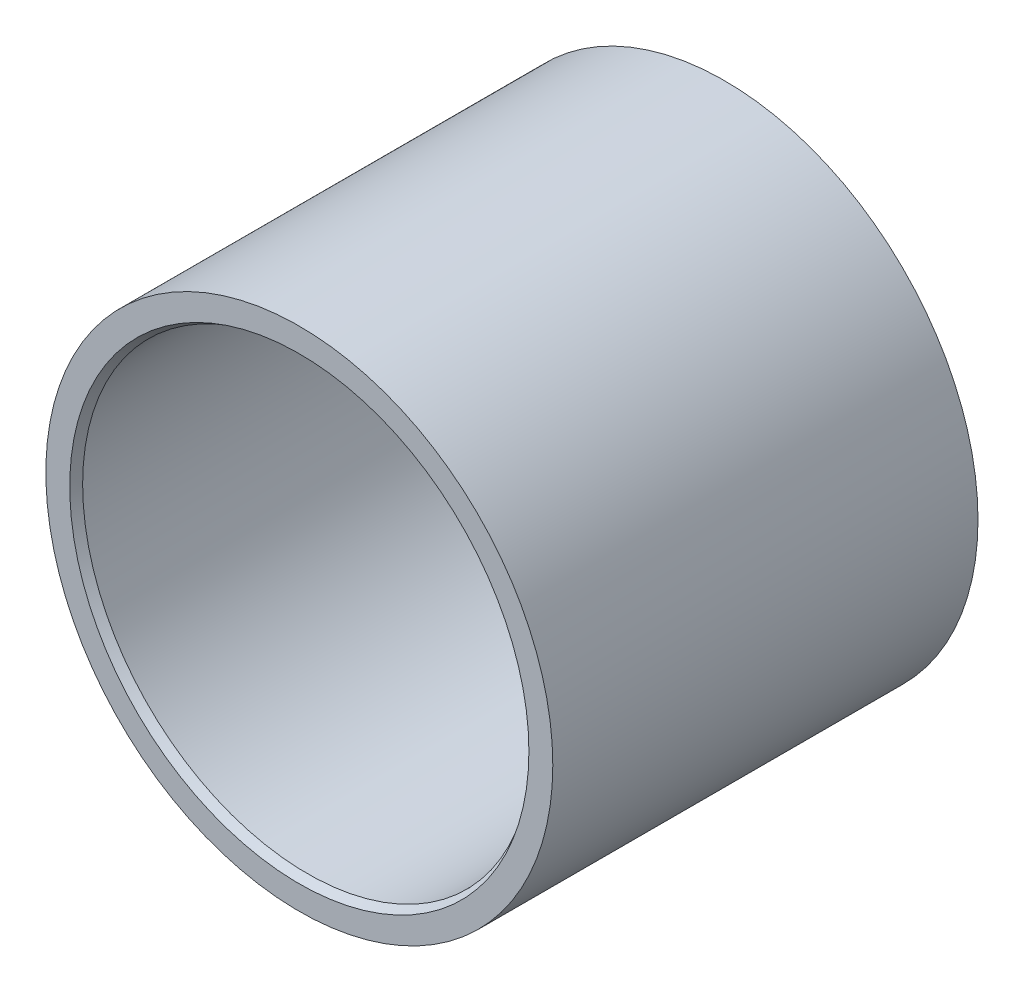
SolidWorks part; units mm, degrees
ref_plane "Plan de face" through (0, 0, 0) normal (0, 0, 1) x (1, 0, 0)
ref_plane "Plan de dessus" through (0, 0, 0) normal (0, 1, 0) x (1, 0, 0)
ref_plane "Plan de droite" through (0, 0, 0) normal (1, 0, 0) x (0, 0, -1)
sketch "Esquisse1" plane through (0, 0, 0) normal (1, 0, 0) x (0, 0, -1)
  line L0 (0, 0) -> (75.9836, 0) construction
  line L1 (1, 27.5) -> (52, 27.5)
  line L2 (52, 27.5) -> (52, 31)
  line L3 (52, 31) -> (0, 31)
  line L4 (0, 31) -> (0, 28.0774)
  line L5 (0, 28.0774) -> (1, 27.5)
  point P3 (0, 27.5)
  dimension "D1" = 1
  dimension "D2" = 30
  dimension "D3" = 52
  dimension "D4" = 55
  dimension "D5" = 62
revolve "Révolution1" add sketch "Esquisse1" angle 360 about L0
